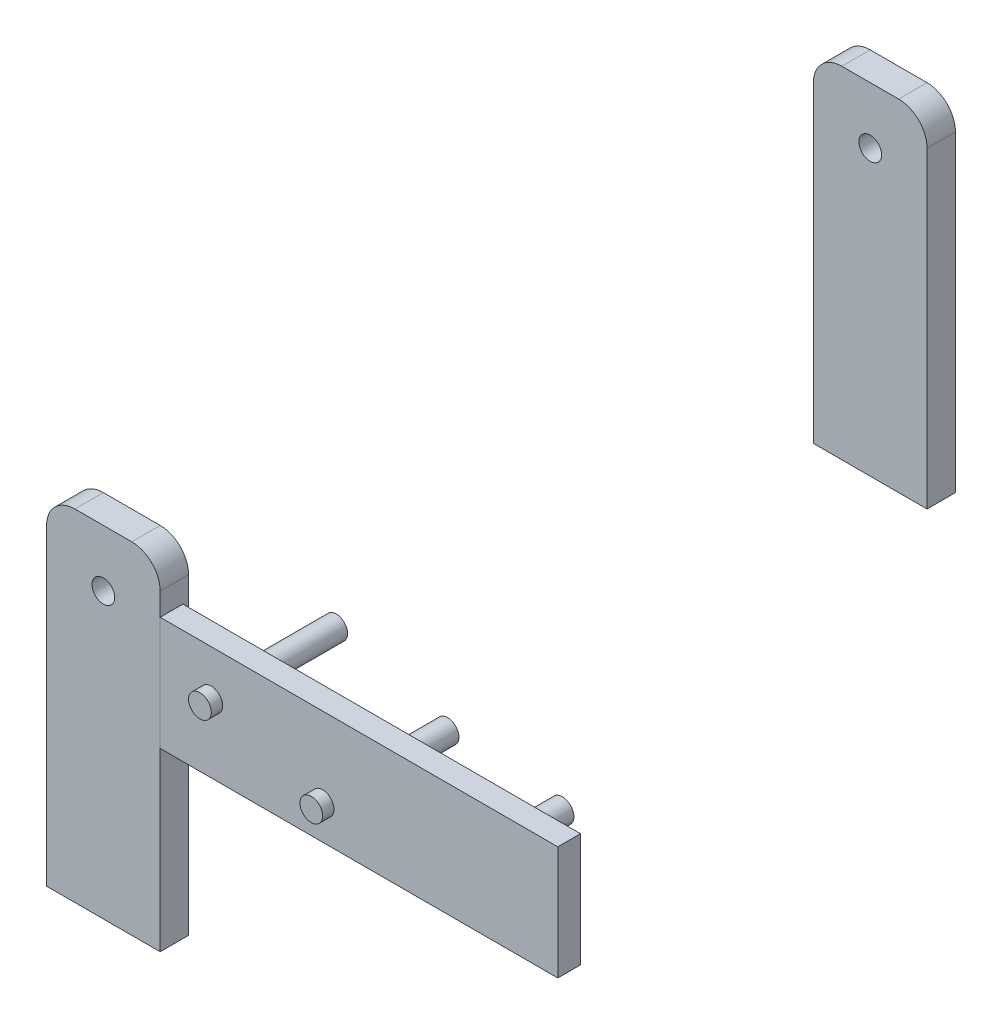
SolidWorks part; units mm, degrees
ref_plane "Front Plane" through (0, 0, 0) normal (0, 0, 1) x (1, 0, 0)
ref_plane "Top Plane" through (0, 0, 0) normal (0, 1, 0) x (1, 0, 0)
ref_plane "Right Plane" through (0, 0, 0) normal (1, 0, 0) x (0, 0, -1)
sketch "Sketch1" plane through (0, 0, 0) normal (0, 0, 1) x (1, 0, 0)
  line L0 (102.5, -5) -> (-102.5, -5) construction
  line L1 (44.0576, -5) -> (34.0576, -5)
  line L2 (44.0576, -5) -> (44.0576, 22.5)
  line L3 (41.5576, 25) -> (36.5576, 25)
  line L4 (34.0576, -5) -> (34.0576, 22.5)
  line L5 (39.0576, 20) -> (39.0576, -5) construction
  arc A0 (44.0576, 22.5) -> (41.5576, 25) centre (41.5576, 22.5) ccw
  arc A1 (36.5576, 25) -> (34.0576, 22.5) centre (36.5576, 22.5) ccw
  circle A2 centre (39.0576, 20) radius 1
  point P8 (44.0576, 25)
  dimension "D3" = 2.5
  dimension "D5" = 2
  dimension "D1" = 10
  dimension "D2" = 30
  dimension "D4" = 25
extrude "Extrude1" add sketch "Sketch1" along normal blind 2.5
ref_plane "Plane1" through (0, 0, 35) normal (0, 0, -1) x (-1, 0, 0)
mirror "Mirror3" about plane through (0, 0, 35) normal (0, 0, -1)
sketch "Sketch2" plane through (0, 0, 70) normal (0, 0, 1) x (1, 0, 0)
  line L0 (44.0576, -5) -> (44.0576, 22.5) construction
  line L1 (44.0576, 20.5) -> (79.0576, 20.5)
  line L2 (44.0576, 20.5) -> (44.0576, 10.5)
  line L3 (44.0576, 10.5) -> (79.0576, 10.5)
  line L4 (79.0576, 20.5) -> (79.0576, 10.5)
  dimension "D1" = 35
  dimension "D2" = 2
  dimension "D3" = 10
extrude "Extrude2" add sketch "Sketch2" against normal blind 2 separate body
sketch "Sketch3" plane through (0, 0, 68) normal (0, 0, -1) x (-1, 0, 0)
  line L0 (-44.0576, 20.5) -> (-44.0576, 10.5) construction
  line L1 (-79.0576, 20.5) -> (-44.0576, 20.5) construction
  circle A0 centre (-48.5576, 16.5) radius 1
  circle A1 centre (-58.3576, 13.5) radius 1
  dimension "D1" = 2
  dimension "D4" = 3
  dimension "D2" = 4.5
  dimension "D3" = 9.8
  dimension "D5" = 4
extrude "Extrude3" add sketch "Sketch3" along normal blind 9 and the other way blind 3
sketch "Sketch4" plane through (0, 0, 68) normal (0, 0, -1) x (-1, 0, 0)
  circle A0 centre (-68.4576, 12.5) radius 1.0188
  circle A1 centre (-58.3576, 13.5) radius 1 construction
  dimension "D1" = 1
  dimension "D2" = 10.1
extrude "Extrude4" add sketch "Sketch4" along normal blind 9
